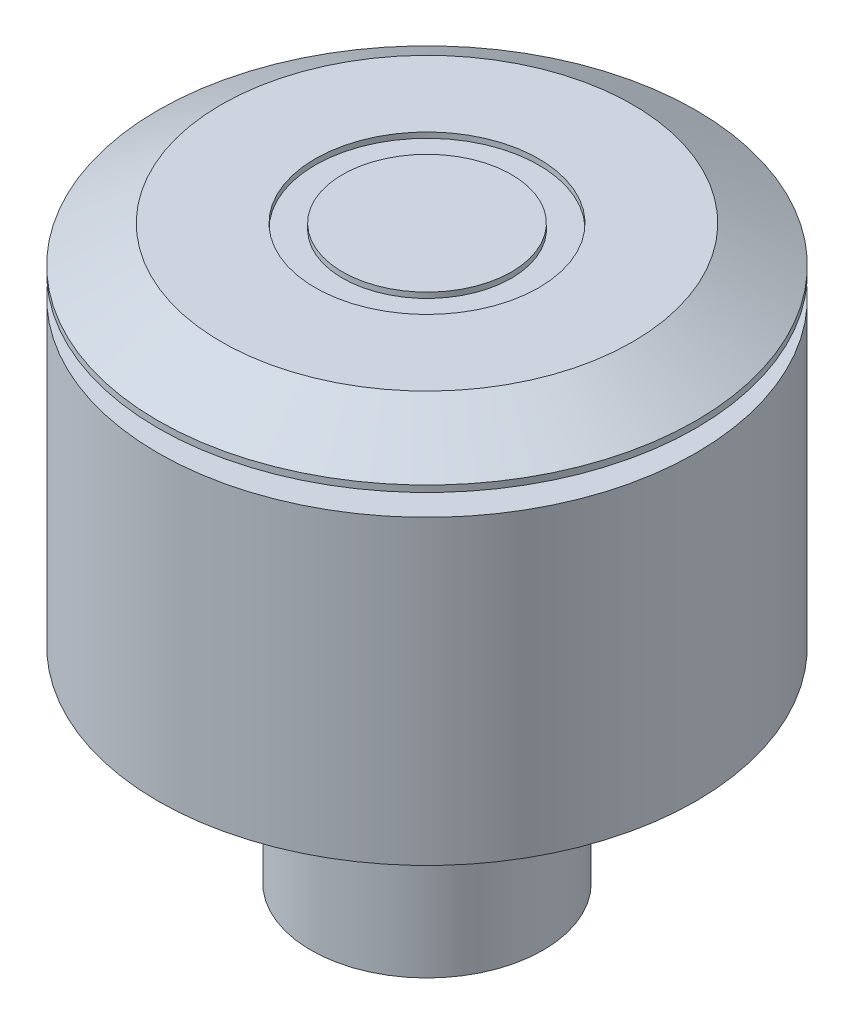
SolidWorks part; units mm, degrees
ref_plane "Front" through (0, 0, 0) normal (0, 0, 1) x (1, 0, 0)
ref_plane "Top" through (0, 0, 0) normal (0, 1, 0) x (1, 0, 0)
ref_plane "Right" through (0, 0, 0) normal (1, 0, 0) x (0, 0, -1)
sketch "Sketch1" plane through (0, 0, 0) normal (0, 0, 1) x (1, 0, 0)
  line L0 (0, -1000) -> (0, 49000) construction
  line L1 (0, 0) -> (5.3975, 0)
  line L2 (5.3975, 0) -> (5.3975, 9.5504)
  line L3 (5.3975, 9.5504) -> (12.5, 9.5504)
  line L4 (11, 24.5618) -> (11, 23.5618)
  line L5 (11, 24.5618) -> (12.5, 24.5618)
  line L6 (12.5, 24.5618) -> (12.5, 24.8618)
  line L7 (12.5, 24.8618) -> (9.5555, 26.5618)
  line L8 (9.5555, 26.5618) -> (5.1943, 26.5618)
  line L9 (5.1943, 26.5618) -> (5.1943, 26.3078)
  line L10 (5.1943, 26.3078) -> (3.9243, 26.3078)
  line L11 (3.9243, 26.3078) -> (3.9243, 26.5618)
  line L12 (3.9243, 26.5618) -> (0, 26.5618)
  line L13 (0, 26.5618) -> (0, 0)
  line L14 (11, 23.5618) -> (12.5, 23.5618)
  line L15 (12.5, 23.5618) -> (12.5, 9.5504)
  dimension "D1" = 10.795
  dimension "D2" = 22
  dimension "D3" = 15.0114
  dimension "D4" = 24.5618
  dimension "D5" = 0.3
  dimension "D6" = 2
  dimension "D7" = 25
  dimension "D8" = 30
  dimension "D9" = 10.3886
  dimension "D10" = 1.27
  dimension "D11" = 0.254
  dimension "D12" = 19.111
  dimension "D13" = 1
revolve "Revolve1" add sketch "Sketch1" angle 360 mid plane about L0
